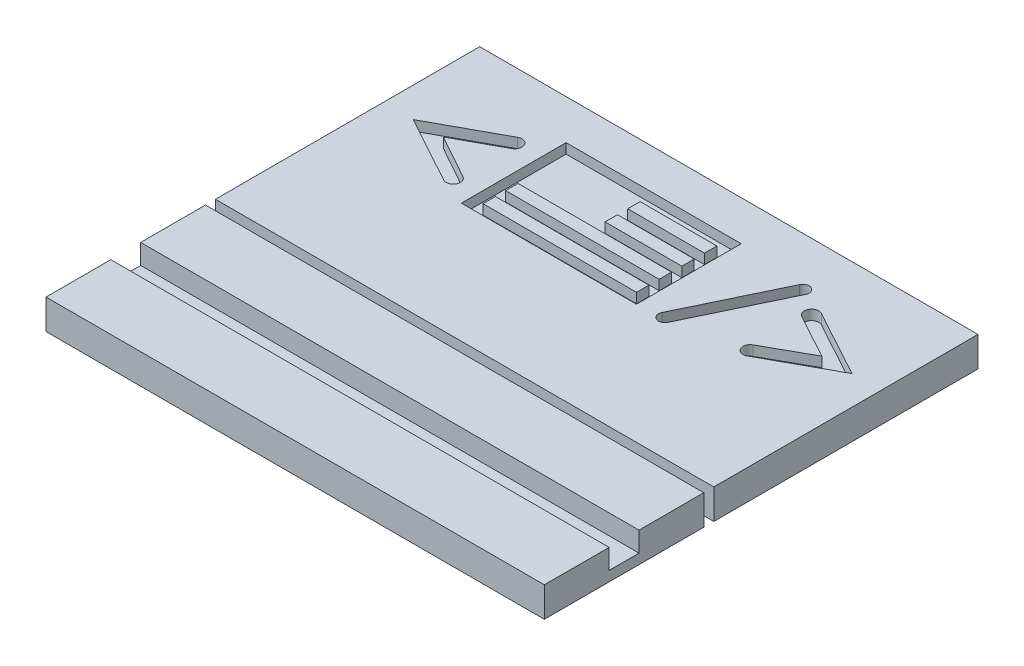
SolidWorks part; units mm, degrees
ref_plane "Front" through (0, 0, 0) normal (0, 0, 1) x (1, 0, 0)
ref_plane "Top" through (0, 0, 0) normal (0, 1, 0) x (1, 0, 0)
ref_plane "Right" through (0, 0, 0) normal (1, 0, 0) x (0, 0, -1)
sketch "Sketch1" plane through (0, 0, 0) normal (0, 1, 0) x (1, 0, 0)
  line L0 (51.7004, 220.72) -> (377.7004, 220.72) construction
sketch "Sketch2" plane through (0, 0, 0) normal (0, 1, 0) x (1, 0, 0)
  line L0 (0, 254) -> (317.5, 254) construction
  line L1 (0, 0) -> (317.5, 0) construction
  line L2 (0, 0) -> (0, 508) construction
  line L3 (0, 508) -> (317.5, 508) construction
  line L4 (317.5, 0) -> (317.5, 508) construction
  line L5 (158.75, 508) -> (158.75, 0) construction
  line L6 (19.05, 0) -> (19.05, 508) construction
  line L7 (298.45, 0) -> (298.45, 508) construction
  line L8 (0, 482.6) -> (317.5, 482.6) construction
  line L9 (19.05, 446.626) -> (62.0529, 470.0814)
  line L10 (233.2186, 478.7039) -> (204.7302, 419.3663)
  line L11 (66.4582, 462.0048) -> (38.2629, 446.626)
  line L12 (38.2629, 446.626) -> (66.4582, 430.8938)
  line L13 (240.5498, 475.1841) -> (212.0614, 415.8466)
  line L14 (62.0529, 422.9986) -> (19.05, 446.626)
  line L15 (136.5953, 459.1942) -> (185.5083, 459.1942)
  line L16 (80.474, 482.6) -> (192.03, 482.6)
  line L17 (279.7521, 446.2529) -> (251.5568, 430.5207)
  line L18 (255.9621, 422.6255) -> (298.965, 446.2529)
  line L19 (251.5568, 461.6317) -> (279.7521, 446.2529)
  line L20 (298.965, 446.2529) -> (255.9621, 469.7083)
  line L21 (80.474, 482.6) -> (80.474, 415.8466)
  line L22 (80.474, 415.8466) -> (192.03, 415.8466)
  line L23 (192.03, 482.6) -> (192.03, 415.8466)
  line L24 (136.5953, 473.6217) -> (185.5083, 473.6217)
  line L25 (136.5953, 473.6217) -> (136.5953, 465.727)
  line L26 (136.5953, 465.727) -> (185.5083, 465.727)
  line L27 (185.5083, 473.6217) -> (185.5083, 465.727)
  line L28 (136.5953, 459.1942) -> (136.5953, 451.2995)
  line L29 (136.5953, 451.2995) -> (185.5083, 451.2995)
  line L30 (185.5083, 459.1942) -> (185.5083, 451.2995)
  line L31 (87.6822, 430.3393) -> (185.5083, 430.3393)
  line L32 (87.6822, 444.7667) -> (185.5083, 444.7667)
  line L33 (87.6822, 444.7667) -> (87.6822, 436.872)
  line L34 (87.6822, 436.872) -> (185.5083, 436.872)
  line L35 (185.5083, 444.7667) -> (185.5083, 436.872)
  line L36 (87.6822, 430.3393) -> (87.6822, 422.4445)
  line L37 (87.6822, 422.4445) -> (185.5083, 422.4445)
  line L38 (185.5083, 430.3393) -> (185.5083, 422.4445)
  line L39 (185.5083, 465.727) -> (185.5083, 459.1942) construction
  line L40 (185.5083, 451.2995) -> (185.5083, 444.7667) construction
  line L41 (185.5083, 436.872) -> (185.5083, 430.3393) construction
  arc A0 (66.4582, 462.0048) -> (62.0529, 470.0814) centre (64.2556, 466.0431) ccw
  arc A1 (62.0529, 422.9986) -> (66.4582, 430.8938) centre (64.2556, 426.9462) ccw
  arc A2 (204.7302, 419.3663) -> (212.0614, 415.8466) centre (208.3958, 417.6064) ccw
  arc A3 (240.5498, 475.1841) -> (233.2186, 478.7039) centre (236.8842, 476.944) ccw
  arc A4 (255.9621, 422.6255) -> (251.5568, 430.5207) centre (253.7595, 426.5731) cw
  arc A5 (251.5568, 461.6317) -> (255.9621, 469.7083) centre (253.7595, 465.67) cw
  dimension "D1" = 317.5
  dimension "D2" = 508
  dimension "D3" = 19.05
  dimension "D4" = 19.05
  dimension "D5" = 25.4
sketch "Sketch3" plane through (0, 0, 0) normal (0, 1, 0) x (1, 0, 0)
  line L0 (0, 508) -> (317.5, 508)
  line L1 (317.5, 508) -> (317.5, 0)
  line L2 (317.5, 0) -> (0, 0)
  line L3 (0, 0) -> (0, 508)
extrude "Boss-Extrude3" add sketch "Sketch3" against normal blind 19.05
extrude "Cut-Extrude1" cut sketch "Sketch2" against normal blind 6.35
sketch "Sketch4" plane through (0, 0, 0) normal (0, 1, 0) x (1, 0, 0)
  line L0 (0, 508) -> (0, 0) construction
  line L1 (0, 339.6466) -> (317.5, 339.6466)
  line L2 (0, 339.6466) -> (0, 333.2966)
  line L3 (0, 333.2966) -> (317.5, 333.2966)
  line L4 (317.5, 339.6466) -> (317.5, 333.2966)
  line L5 (317.5, 0) -> (317.5, 508) construction
  line L6 (80.474, 415.8466) -> (192.03, 415.8466) construction
  dimension "D1" = 6.35
  dimension "D2" = 76.2
extrude "Cut-Extrude2" cut sketch "Sketch4" against normal blind 19.05
sketch "Sketch5" plane through (0, 0, 0) normal (0, 1, 0) x (1, 0, 0)
  line L0 (0, 231.6966) -> (317.5, 231.6966)
  line L1 (0, 333.2966) -> (0, 0) construction
  line L2 (317.5, 0) -> (317.5, 333.2966) construction
  line L3 (0, 333.2966) -> (317.5, 333.2966) construction
  line L5 (0, 231.6966) -> (0, 225.3466)
  line L6 (0, 225.3466) -> (317.5, 225.3466)
  line L7 (317.5, 225.3466) -> (317.5, 231.6966)
  dimension "D1" = 101.6
  dimension "D2" = 6.35
extrude "Cut-Extrude3" cut sketch "Sketch5" against normal blind 19.05
sketch "Sketch6" plane through (0, 0, 0) normal (0, 1, 0) x (1, 0, 0)
  line L0 (0, 333.2966) -> (0, 231.6966) construction
  line L1 (0, 292.0216) -> (317.5, 292.0216)
  line L2 (0, 292.0216) -> (0, 272.9716)
  line L3 (0, 272.9716) -> (317.5, 272.9716)
  line L4 (317.5, 292.0216) -> (317.5, 272.9716)
  line L5 (317.5, 231.6966) -> (317.5, 333.2966) construction
  line L6 (0, 333.2966) -> (317.5, 333.2966) construction
  dimension "D1" = 19.05
  dimension "D2" = 41.275
extrude "Cut-Extrude4" cut sketch "Sketch6" against normal blind 12.7
sketch "Sketch7" plane through (0, 0, 0) normal (0, 1, 0) x (1, 0, 0)
  line L1 (0, 225.3466) -> (317.5, 225.3466)
  line L2 (0, 225.3466) -> (0, 0)
  line L3 (0, 0) -> (317.5, 0)
  line L4 (317.5, 225.3466) -> (317.5, 0)
extrude "Cut-Extrude5" cut sketch "Sketch7" against normal through all
sketch "Sketch9" plane through (0, -19.05, 0) normal (0, -1, 0) x (1, 0, 0)
  line L0 (317.5, -339.6466) -> (0, -339.6466) construction
  line L1 (292.1, -339.6466) -> (279.4, -339.6466)
  line L2 (292.1, -339.6466) -> (292.1, -333.2966)
  line L3 (292.1, -333.2966) -> (279.4, -333.2966)
  line L4 (279.4, -339.6466) -> (279.4, -333.2966)
  line L5 (0, -333.2966) -> (317.5, -333.2966) construction
  line L7 (165.1, -339.6466) -> (152.4, -339.6466)
  line L8 (165.1, -339.6466) -> (165.1, -333.2966)
  line L9 (165.1, -333.2966) -> (152.4, -333.2966)
  line L10 (152.4, -339.6466) -> (152.4, -333.2966)
  line L11 (38.1, -339.6466) -> (25.4, -339.6466)
  line L12 (38.1, -339.6466) -> (38.1, -333.2966)
  line L13 (38.1, -333.2966) -> (25.4, -333.2966)
  line L14 (25.4, -339.6466) -> (25.4, -333.2966)
  point P16 (158.75, -339.6466)
  point P17 (158.75, -339.6466)
  dimension "D1" = 12.7
  dimension "D2" = 12.7
  dimension "D3" = 12.7
  dimension "D4" = 25.4
  dimension "D5" = 25.4
extrude "Boss-Extrude4" add sketch "Sketch9" against normal blind 3.175
